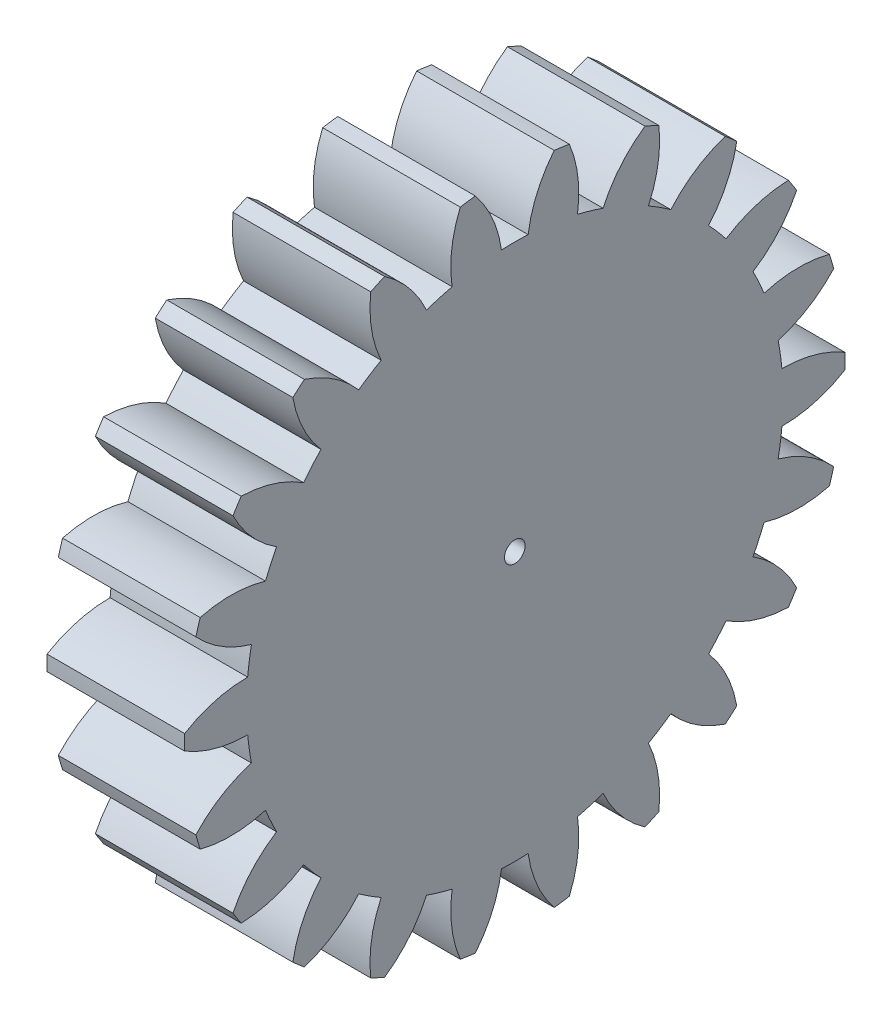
SolidWorks part; units mm, degrees
ref_plane "Plane1" through (0, 0, 0) normal (0, 0, 1) x (1, 0, 0)
ref_plane "Plane2" through (0, 0, 0) normal (0, 1, 0) x (1, 0, 0)
ref_plane "Plane3" through (0, 0, 0) normal (1, 0, 0) x (0, 0, -1)
other "Configuration Table"
sketch "HoldingSke" plane through (0, 0, 0) normal (0, 1, 0) x (1, 0, 0)
  line L0 (0, 0) -> (0.4636, -0.1873)
  line L1 (-15, 0) -> (100, 0) construction
  line L2 (0, 0) -> (-2.1039, 2.3779)
  line L3 (0, 0) -> (-11.863, 4.5341)
  line L4 (0, 0) -> (8.0072, 3.2351)
  line L5 (0, 0) -> (-46.8476, -17.4728)
  line L6 (0, 0) -> (-8.2896, -5.593)
  line L7 (-2.1039, 2.3779) -> (8.6586, 51.2059)
  line L8 (-76.2, 54.61) -> (-76, 54.61)
  line L9 (-71.009, 38.7566) -> (-53.1078, 45.2721)
  line L10 (-76.2, 71.12) -> (104.1128, 71.12)
  line L11 (0, 0) -> (-10, 0)
  line L12 (-76.2, 101.6) -> (-76.133, 101.6)
  line L13 (24.9733, 27.94) -> (52.9518, 28.4284)
  line L14 (24.9733, 27.94) -> (24.9743, 27.94)
  line L15 (24.9733, 27.94) -> (100.4006, 29.5858)
  line L16 (-63.627, -2) -> (-12.827, -2)
  circle A0 centre (0, 0) radius 0.75
  circle A1 centre (0, 0) radius 19.499
  circle A2 centre (0, 0) radius 37.5
  circle A3 centre (0, 0) radius 0.75
sketch "BasProSke" plane through (0, 0, 0) normal (0, 1, 0) x (1, 0, 0)
  line L0 (-10, 0) -> (60, 0) construction
  line L1 (0, 0) -> (0, 24)
  line L2 (0, 0) -> (10, 0)
  line L3 (10, 0) -> (10, 24)
  line L4 (10, 24) -> (0, 24)
revolve "Base-Revolve" add sketch "BasProSke" angle 360 about L0
sketch "TooCutSke" plane through (0, 0, 0) normal (1, 0, 0) x (0, 0, -1)
  line L1 (0, 0) -> (0, 107) construction
  line L2 (0, 0) -> (-1.6867, 21.9352) construction
  line L3 (0, 0) -> (-6.2482, 43.4572) construction
  line L4 (-1.6867, 21.9352) -> (-3.1241, 21.7286) construction
  arc A0 (0.9682, 19.4749) -> (-0.9682, 19.4749) centre (0, 0) ccw
  arc A1 (2.8856, 23.8515) -> (-2.8856, 23.8515) centre (0, 0) ccw
  circle A2 centre (0, 0) radius 22 construction
  circle A3 centre (0, 0) radius 20.6732 construction
  arc A4 (-0.9682, 19.4749) -> (-2.8856, 23.8515) centre (-9.6845, 18.2645) ccw
  arc A5 (2.8856, 23.8515) -> (0.9682, 19.4749) centre (9.6845, 18.2645) ccw
extrude "ToothCut" cut sketch "TooCutSke" along normal through all
fillet "Breaks" [suppressed] radius 0.04
fillet "RootFillets" [suppressed] radius 0.501
pattern_circular "TeethCuts" count 22 every 16.364 about axis through (-10, 0, 0) along (1, 0, 0) of "ToothCut", "RootFillets", "Breaks"
sketch "HubNeaOneSke" plane through (0, 0, 0) normal (-1, 0, 0) x (0, 0, 1)
  circle A0 centre (0, 0) radius 19.499
extrude "HubNearOne" [suppressed] add sketch "HubNeaOneSke" along normal blind 40.0001
sketch "HubNeaBotSke" plane through (0, 0, 0) normal (-1, 0, 0) x (0, 0, 1)
  circle A0 centre (0, 0) radius 19.499
extrude "HubNearBoth" [suppressed] add sketch "HubNeaBotSke" along normal blind 20
ref_plane "FarPln" through (10, 0, 0) normal (1, 0, 0) x (0, 0, -1)
sketch "HubFarSke" plane through (10, 0, 0) normal (1, 0, 0) x (0, 0, -1)
  circle A0 centre (0, 0) radius 19.499
extrude "HubFar" [suppressed] add sketch "HubFarSke" along normal blind 20
sketch "BorSke" plane through (0, 0, 0) normal (1, 0, 0) x (0, 0, -1)
  circle A0 centre (0, 0) radius 0.75
extrude "Bore" cut sketch "BorSke" along normal mid plane 100.0001
sketch "KeySke" plane through (0, 0, 0) normal (1, 0, 0) x (0, 0, -1)
  line L0 (-0.3, 0) -> (-0.3, 0.95)
  line L1 (-0.3, 0.95) -> (0.3, 0.95)
  line L2 (0.3, 0.95) -> (0.3, 0)
  line L3 (0, 0) -> (0, 34) construction
  line L4 (-0.3, 0) -> (0.3, 0)
extrude "Keyway" [suppressed] cut sketch "KeySke" along normal mid plane 100.0001
pattern_circular "Keyway2" [suppressed] count 2 every 90 about axis through (-10, 0, 0) along (1, 0, 0)
equation "' \"Module@HoldingSke\" = 6.35"
equation "' \"Num_teeth@HoldingSke\" = 12"
equation "' \"Ap@HoldingSke\" =  20"
equation "' \"Ap@HoldingSke\" = 20"
equation "' \"Width@HoldingSke\" = 0.5 * 25.4"
equation "' \"Hub_dia@HoldingSke\"= 1 * 25.4"
equation "' \"Hub_dia@HoldingSke\" = 1 * 25.4"
equation "' \"Overall_len@HoldingSke\" = 1.0 * 25.4"
equation "' \"Bore@HoldingSke\" = 0.75 * 25.4"
equation "' \"T_dim@HoldingSke\" = 0.1 * 25.4"
equation "' \"Width@KeySke\" = 0.25 * 25.4"
equation "' \"Show_teeth@HoldingSke\" = 13"
equation "' \"Backlash@HoldingSke\" = 0.009 * 25.4"
equation "' \"Addendum_fac@HoldingSke\" = 1.0"
equation "' \"Dedendum_fac@HoldingSke\" = 1.25"
equation "' \"Dedendum_add@HoldingSke\" = 0.00005 * 25.4"
equation "' \"Clearance_fac@HoldingSke\" = 0.25"
equation "\"Pitch@HoldingSke\" = 1 / \"Module@HoldingSke\""
equation "\"Overcut_dia@TooCutSke\" = (\"Num_teeth@HoldingSke\" + 2 * \"Addendum_fac@HoldingSke\") / \"Pitch@HoldingSke\" + 0.002 * 25.4"
equation "\"Pitch_dia@TooCutSke\" = \"Num_teeth@HoldingSke\" / \"Pitch@HoldingSke\""
equation "\"Base_dia@TooCutSke\" = \"Num_teeth@HoldingSke\" / \"Pitch@HoldingSke\" * cos((\"Ap@HoldingSke\"  * 3.14159265 / 180))"
equation "\"Root_dia@TooCutSke\" = (\"Num_teeth@HoldingSke\" + 2) / \"Pitch@HoldingSke\" - 2 * (\"Addendum_fac@HoldingSke\" + \"Dedendum_fac@HoldingSke\") / \"Pitch@HoldingSke\" - \"Dedendum_add@HoldingSke\" * 2"
equation "\"Half_ang@TooCutSke\" = 180 / \"Num_teeth@HoldingSke\""
equation "\"Half_CT@TooCutSke\" = \"Num_teeth@HoldingSke\" / \"Pitch@HoldingSke\" * sin((3.14159265 / 2 / \"Num_teeth@HoldingSke\")) / 2 - 7 * \"Backlash@HoldingSke\" / 4"
equation "\"Flank_rad@TooCutSke\" = \"Num_teeth@HoldingSke\" / \"Pitch@HoldingSke\" / 5"
equation "\"Radius@RootFillets\" = \"Clearance_fac@HoldingSke\" / \"Pitch@HoldingSke\" + \"Dedendum_add@HoldingSke\""
equation "\"Break_rad@Breaks\" = 0.02 / \"Pitch@HoldingSke\""
equation "\"Thickness@HoldingSke\" = \"Width@HoldingSke\""
equation "\"OAL@HoldingSke\" = \"Thickness@HoldingSke\""
equation "\"MHD@HoldingSke\" = (\"Num_teeth@HoldingSke\" + 2) / \"Pitch@HoldingSke\" - 2 * (\"Addendum_fac@HoldingSke\" + \"Dedendum_fac@HoldingSke\")  / \"Pitch@HoldingSke\" - \"Dedendum_add@HoldingSke\" * 2"
equation "\"MBD@HoldingSke\" = (\"Num_teeth@HoldingSke\" + 2) / \"Pitch@HoldingSke\" - 2 * (\"Addendum_fac@HoldingSke\" + \"Dedendum_fac@HoldingSke\")  / \"Pitch@HoldingSke\" - \"Dedendum_add@HoldingSke\" * 2 - 0.002 * 25.4"
equation "\"MHD@HoldingSke\" = ((sgn( \"MHD@HoldingSke\" - \"Hub_dia@HoldingSke\" )-1)*( \"MHD@HoldingSke\" - \"Hub_dia@HoldingSke\" ))/-2+ \"Hub_dia@HoldingSke\""
equation "\"MBD@HoldingSke\" = ((sgn( \"MBD@HoldingSke\" - \"Bore@HoldingSke\" )-1)*( \"MBD@HoldingSke\" - \"Bore@HoldingSke\" ))/-2+ \"Bore@HoldingSke\""
equation "\"OAL@HoldingSke\" = ((sgn( \"OAL@HoldingSke\" - \"Overall_len@HoldingSke\" )+1)*( \"OAL@HoldingSke\" - \"Overall_len@HoldingSke\" ))/2 + \"Overall_len@HoldingSke\" + 0.000002 * 25.4"
equation "\"Num_teeth@TeethCuts\" = int( \"Show_teeth@HoldingSke\" ) + 1"
equation "\"Num_teeth@TeethCuts\" = ((sgn( \"Num_teeth@TeethCuts\" - \"Num_teeth@HoldingSke\" )-1)*( \"Num_teeth@TeethCuts\" - \"Num_teeth@HoldingSke\" ))/-2+ \"Num_teeth@HoldingSke\""
equation "\"Num_teeth@TeethCuts\" = ((sgn( \"Num_teeth@TeethCuts\" - 2.0)+1)*( \"Num_teeth@TeethCuts\" - 2.0))/2 +2.0"
equation "\"Angle@TeethCuts\" = 360.0 / \"Num_teeth@HoldingSke\""
equation "\"Diameter@BasProSke\" = (\"Num_teeth@HoldingSke\" + 2 * \"Addendum_fac@HoldingSke\") / \"Pitch@HoldingSke\""
equation "\"Thickness@BasProSke\"  = \"Thickness@HoldingSke\""
equation "' \"Fillet_rad@BasProSke\" =  \"Thickness@HoldingSke\" * 0.05"
equation "' \"Fillet_rad@BasProSke\" = \"Thickness@HoldingSke\" * 0.05"
equation "\"MHD@HoldingSke\" = ((sgn( \"MHD@HoldingSke\" - \"Root_dia@TooCutSke\" )-1)*( \"MHD@HoldingSke\" - \"Root_dia@TooCutSke\" ))/-2+ \"Root_dia@TooCutSke\""
equation "\"Diameter@HubNeaOneSke\" = \"MHD@HoldingSke\""
equation "\"Length@HubNearOne\" = \"OAL@HoldingSke\" - \"Thickness@BasProSke\""
equation "\"Diameter@HubNeaBotSke\" = \"MHD@HoldingSke\""
equation "\"Length@HubNearBoth\" = ( \"OAL@HoldingSke\" - \"Thickness@BasProSke\" ) / 2.0"
equation "\"Thickness@FarPln\" = \"Thickness@BasProSke\""
equation "\"Diameter@HubFarSke\" = \"MHD@HoldingSke\""
equation "\"Length@HubFar\" = ( \"OAL@HoldingSke\" - \"Thickness@BasProSke\" ) / 2.0"
equation "\"Diameter@BorSke\" = \"MBD@HoldingSke\""
equation "\"D1@Bore\" = \"OAL@HoldingSke\" * 2.0"
equation "\"D1@Keyway\" = \"OAL@HoldingSke\" * 2.0"
equation "\"Offset@KeySke\" = \"T_dim@HoldingSke\" + \"MBD@HoldingSke\" / 2.0"
